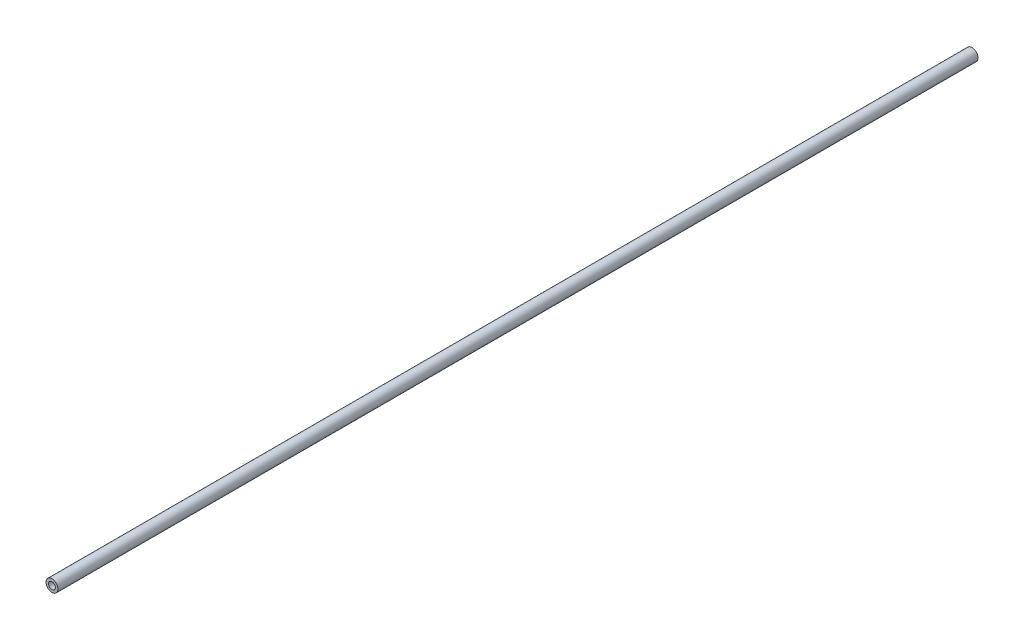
SolidWorks part; units mm, degrees
ref_plane "Plan de face" through (0, 0, 0) normal (0, 0, 1) x (1, 0, 0)
ref_plane "Plan de dessus" through (0, 0, 0) normal (0, 1, 0) x (1, 0, 0)
ref_plane "Plan de droite" through (0, 0, 0) normal (1, 0, 0) x (0, 0, -1)
sketch "Esquisse1" plane through (0, 0, 0) normal (0, 0, 1) x (1, 0, 0)
  circle A0 centre (0, 0) radius 6
  dimension "D1" = 12
extrude "Extrusion1" add sketch "Esquisse1" along normal mid plane 925
hole_wizard "Trou taraudé M8x1.252" positions "Esquisse5" profile "Esquisse4" tap size "M8x1.25" standard "DIN"
sketch "Esquisse5" plane through (0, 0, -462.5) normal (0, 0, -1) x (-1, 0, 0)
  circle A0 centre (0, 0) radius 6 construction
  point P0 (0, 0)
sketch "Esquisse4" plane through (0, 0, -462.5) normal (1, 0, 0) x (0, 1, 0)
  line L0 (0, 0) -> (0, 21.7929)
  line L1 (0, 21.7929) -> (3.4, 19.75)
  line L2 (3.4, 19.75) -> (3.4, 0)
  line L5 (3.4, 0) -> (0, 0)
  line L10 (0, 21.7929) -> (-3.4, 19.75) construction
  line L11 (0, -6.35) -> (0, 107.95) construction
  dimension "Diamètre du trou pour taraudage" = 6.8
  dimension "Profondeur du trou pour taraudage" = 19.75
  dimension "Angle de pointe" = 118
mirror "Symétrie1" about plane through (0, 0, 0) normal (0, 0, 1) of "Trou taraudé M8x1.252"
